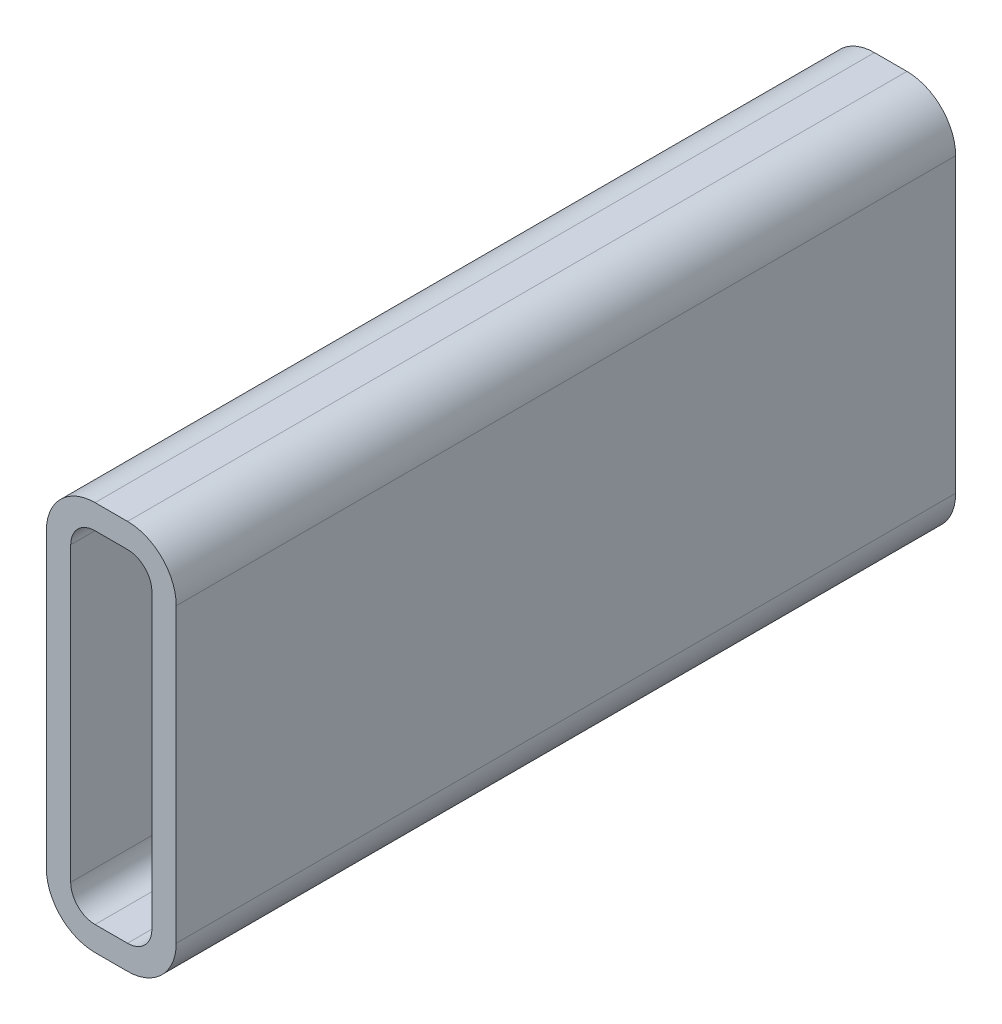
SolidWorks part; units mm, degrees
ref_plane "Front Plane" through (0, 0, 0) normal (0, 0, 1) x (1, 0, 0)
ref_plane "Top Plane" through (0, 0, 0) normal (0, 1, 0) x (1, 0, 0)
ref_plane "Right Plane" through (0, 0, 0) normal (1, 0, 0) x (0, 0, -1)
sketch "Sketch1" plane through (0, 0, 0) normal (0, 0, 1) x (1, 0, 0)
  line B0 (19.05, 152.4) -> (31.75, 152.4)
  arc B1 (50.8, 133.35) -> (31.75, 152.4) centre (31.75, 133.35) ccw
  line B2 (50.8, 133.35) -> (50.8, 19.05)
  arc B3 (31.75, 0) -> (50.8, 19.05) centre (31.75, 19.05) ccw
  line B4 (31.75, 0) -> (19.05, 0)
  arc B5 (0, 19.05) -> (19.05, 0) centre (19.05, 19.05) ccw
  line B6 (0, 19.05) -> (0, 133.35)
  arc B7 (19.05, 152.4) -> (0, 133.35) centre (19.05, 133.35) ccw
  line B8 (19.05, 142.875) -> (31.75, 142.875)
  arc B9 (41.275, 133.35) -> (31.75, 142.875) centre (31.75, 133.35) ccw
  line B10 (41.275, 133.35) -> (41.275, 19.05)
  arc B11 (31.75, 9.525) -> (41.275, 19.05) centre (31.75, 19.05) ccw
  line B12 (31.75, 9.525) -> (19.05, 9.525)
  arc B13 (9.525, 19.05) -> (19.05, 9.525) centre (19.05, 19.05) ccw
  line B14 (9.525, 19.05) -> (9.525, 133.35)
  arc B15 (19.05, 142.875) -> (9.525, 133.35) centre (19.05, 133.35) ccw
sketch_block_instance "HSS6x2x0.375-1"
sketch_block "HSS6x2x0.375"
extrude "Boss-Extrude1" add sketch "Sketch1" along normal blind 304.8
